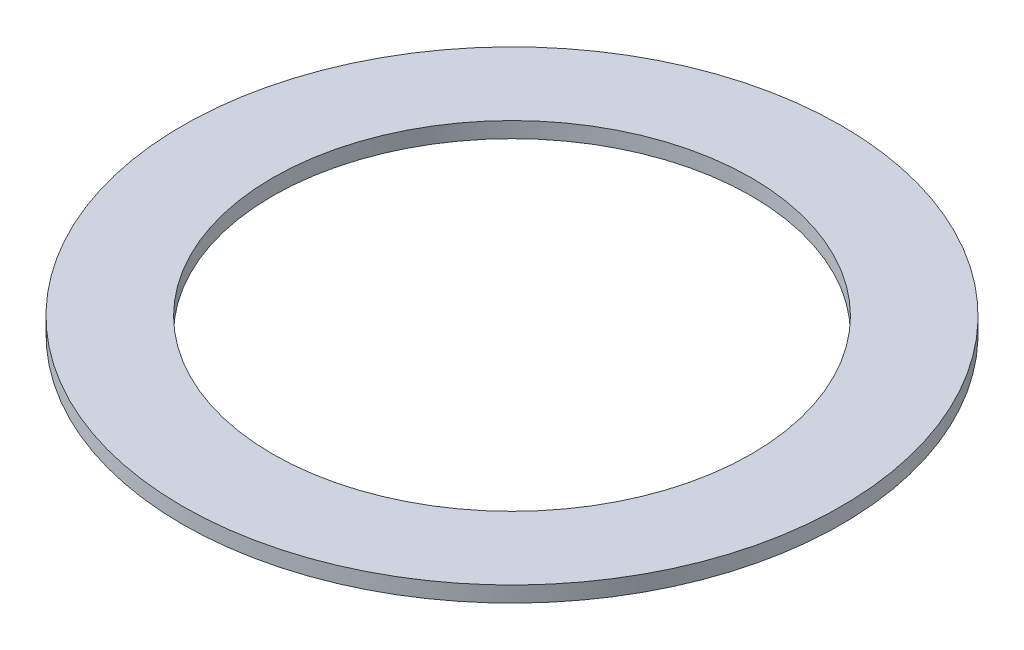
SolidWorks part; units mm, degrees
ref_plane "Face" through (0, 0, 0) normal (0, 0, 1) x (1, 0, 0)
ref_plane "Dessus" through (0, 0, 0) normal (0, 1, 0) x (1, 0, 0)
ref_plane "Droite" through (0, 0, 0) normal (1, 0, 0) x (0, 0, -1)
sketch "Esquisse1" plane through (0, 0, 0) normal (0, 0, 1) x (1, 0, 0)
  line L0 (0, 0) -> (0, 33.7712) construction
  line L1 (15.25, 0) -> (21, 0)
  line L2 (15.25, 0) -> (15.25, 1)
  line L3 (15.25, 1) -> (21, 1)
  line L4 (21, 0) -> (21, 1)
  dimension "D1" = 30.5
  dimension "D2" = 42
  dimension "D3" = 1
revolve "Révolution1" add sketch "Esquisse1" angle 360 about L0
